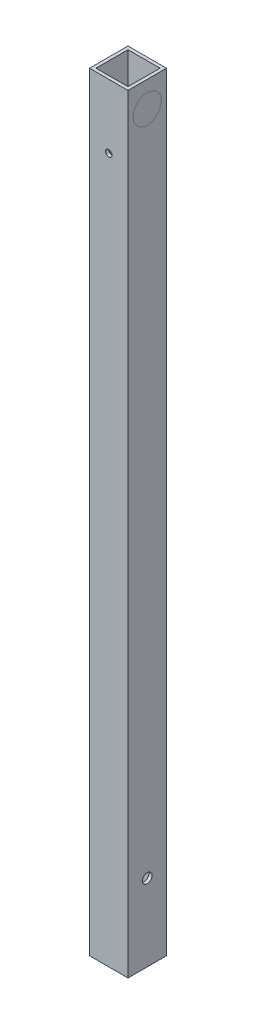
SolidWorks part; units mm, degrees
ref_plane "Front Plane" through (0, 0, 0) normal (0, 0, 1) x (1, 0, 0)
ref_plane "Top Plane" through (0, 0, 0) normal (0, 1, 0) x (1, 0, 0)
ref_plane "Right Plane" through (0, 0, 0) normal (1, 0, 0) x (0, 0, -1)
sketch "tube contours" plane through (0, 0, 0) normal (0, 1, 0) x (1, 0, 0)
  line L1 (-19.05, -19.05) -> (19.05, -19.05)
  line L2 (-19.05, -19.05) -> (-19.05, 19.05)
  line L3 (-19.05, 19.05) -> (19.05, 19.05)
  line L4 (19.05, -19.05) -> (19.05, 19.05)
  line L5 (-19.05, -19.05) -> (19.05, 19.05) construction
  line L6 (-19.05, 19.05) -> (19.05, -19.05) construction
  line L7 (-15.875, -15.875) -> (15.875, -15.875)
  line L8 (-15.875, -15.875) -> (-15.875, 15.875)
  line L9 (-15.875, 15.875) -> (15.875, 15.875)
  line L10 (15.875, -15.875) -> (15.875, 15.875)
  line L11 (-15.875, -15.875) -> (15.875, 15.875) construction
  line L12 (-15.875, 15.875) -> (15.875, -15.875) construction
  point P0 (0, 0)
  point P6 (0, 0)
  dimension "D1" = 38.1
  dimension "D2" = 38.1
  dimension "D3" = 31.75
extrude "Boss-Extrude1" add sketch "tube contours" along normal blind 762
sketch "Sketch4" plane through (-19.05, 0, 0) normal (-1, 0, 0) x (0, 0, 1)
  line L0 (-19.05, 0) -> (19.05, 0) construction
  circle A0 centre (0, 76.2) radius 4.7625
  point P4 (0, 0)
  dimension "D1" = 9.525
  dimension "D2" = 76.2
extrude "Cut-Extrude1" cut sketch "Sketch4" against normal through all
sketch "Sketch7" plane through (19.05, 0, 0) normal (1, 0, 0) x (0, 0, -1)
  line L0 (-19.05, 762) -> (-19.05, 0) construction
  line L1 (-19.05, 762) -> (19.05, 762) construction
  circle A0 centre (0, 736.6) radius 13.97
  dimension "D2" = 27.94
  dimension "D1" = 19.05
  dimension "D3" = 25.4
sketch "Sketch8" plane through (0, 0, -19.05) normal (0, 0, -1) x (-1, 0, 0)
  line L0 (-19.05, 762) -> (19.05, 762) construction
  line L1 (-19.05, 762) -> (-19.05, 0) construction
  circle A0 centre (0, 698.5) radius 3.175
  dimension "D1" = 63.5
  dimension "D3" = 6.35
  dimension "D2" = 19.05
extrude "Cut-Extrude2" cut sketch "Sketch8" against normal through all
equation "\"outer_width\"= \"D1@tube contours\""
equation "\"inner_width\"= \"outer_width\" - 0.25in"
equation "\"D3@tube contours\"=\"inner_width\""
